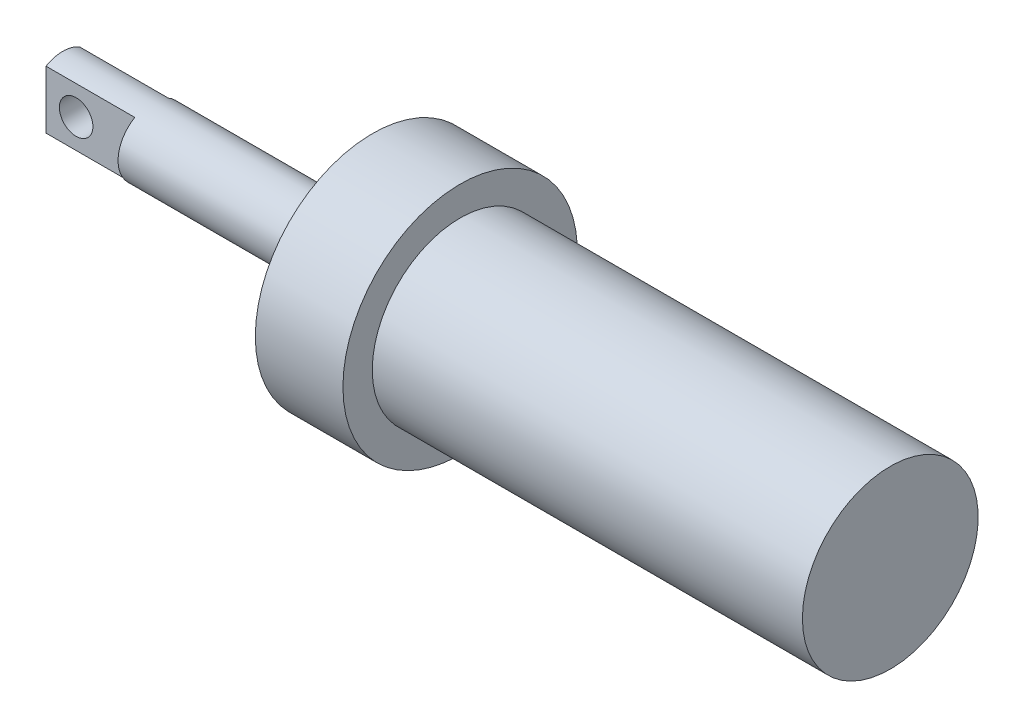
SolidWorks part; units mm, degrees
ref_plane "Front" through (0, 0, 0) normal (0, 0, 1) x (1, 0, 0)
ref_plane "Top" through (0, 0, 0) normal (0, 1, 0) x (1, 0, 0)
ref_plane "Right" through (0, 0, 0) normal (1, 0, 0) x (0, 0, -1)
sketch "Sketch1"
  dimension "D1" = 33.3248
  dimension "D2" = 44.45
  dimension "D3" = 98.171
  dimension "D4" = 16.6116
revolve "Base-Revolve" add sketch "Sketch1" angle 360 about L0
sketch "Sketch2"
  dimension "D1" = 12.7
extrude "Boss-Extrude1" add sketch "Sketch2" along normal blind 58.7375 separate body
ref_plane "Plane1" through (0, -6.35, 0) normal (0, 1, 0) x (-1, 0, 0)
sketch "Sketch3"
  dimension "D1" = 3.175
  dimension "D2" = 16.8402
extrude "Cut-Extrude1" cut sketch "Sketch3" along normal through all
sketch "Sketch9"
  dimension "D2" = 6.35
  dimension "D1" = 5.715
extrude "Cut-Extrude2" cut sketch "Sketch9" against normal through all
